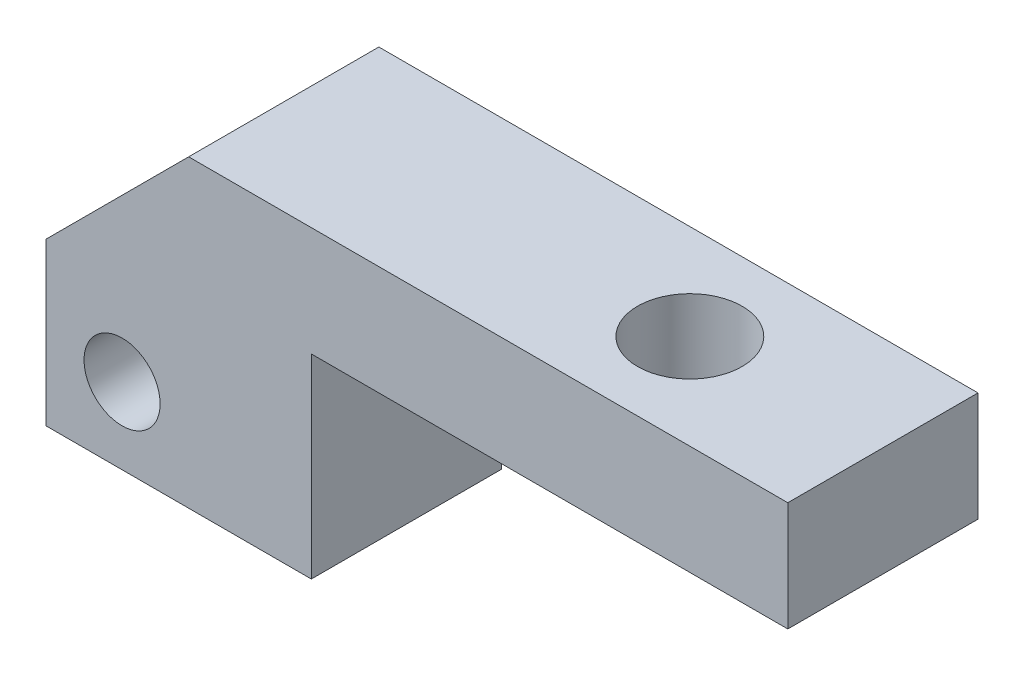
SolidWorks part; units mm, degrees
ref_plane "Face" through (0, 0, 0) normal (0, 0, 1) x (1, 0, 0)
ref_plane "Dessus" through (0, 0, 0) normal (0, 1, 0) x (1, 0, 0)
ref_plane "Droite" through (0, 0, 0) normal (1, 0, 0) x (0, 0, -1)
sketch "Esquisse1" plane through (0, 0, 0) normal (0, 0, 1) x (1, 0, 0)
  line L0 (0, 0) -> (-27.9, 0)
  line L1 (-27.9, 0) -> (-27.9, 32)
  line L2 (-27.9, 32) -> (50.1, 32)
  line L3 (50.1, 32) -> (50.1, 20.5)
  line L4 (50.1, 20.5) -> (0, 20.5)
  line L5 (0, 20.5) -> (0, 0)
  circle A0 centre (-19.9, 8) radius 4
  dimension "D1" = 8
  dimension "D6" = 8
  dimension "D7" = 8
  dimension "D2" = 27.9
  dimension "D3" = 78
  dimension "D4" = 20.5
  dimension "D5" = 32
extrude "Extrusion1" add sketch "Esquisse1" along normal mid plane 20
chamfer "Chanfrein1" distance 15 angle 45 1 edges at (-27.9, 32, 0)
sketch "Esquisse2" plane through (0, 32, 0) normal (0, 1, 0) x (-1, 0, 0)
  line L0 (-50.1, 10) -> (-50.1, -10) construction
  circle A0 centre (-29.8, 0) radius 5.5
  dimension "D1" = 11
  dimension "D2" = 20.3
extrude "Enlèv. mat.-Extru.1" cut sketch "Esquisse2" against normal up to next
